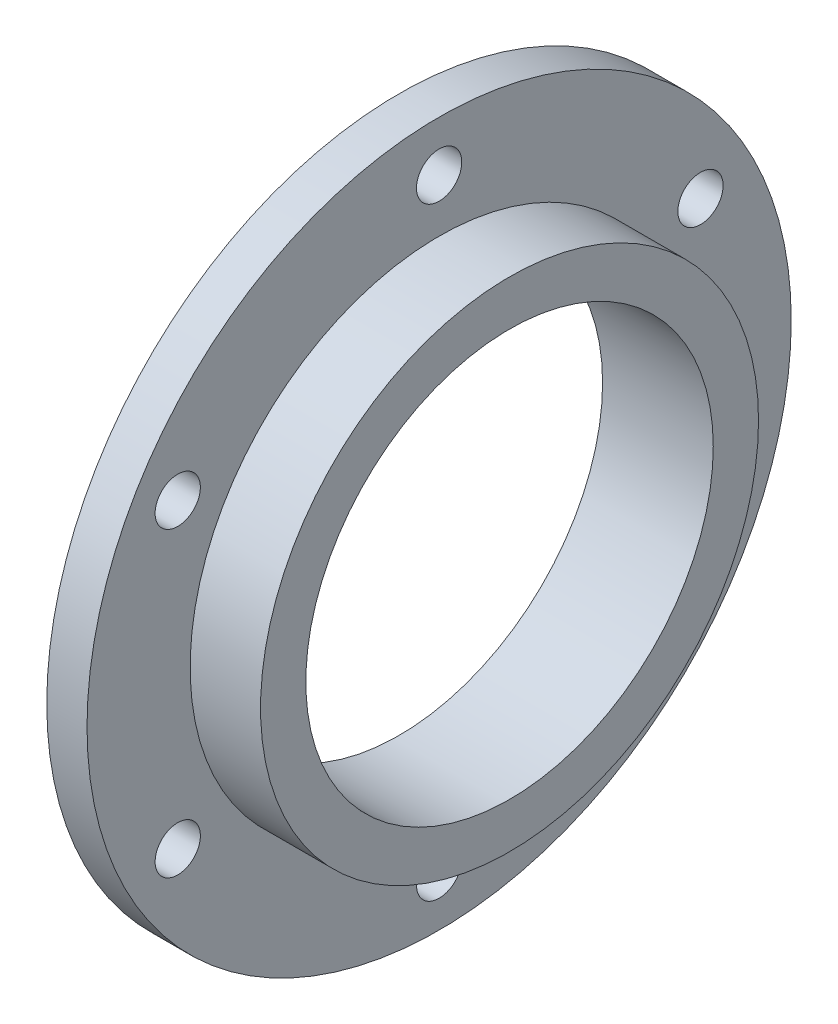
SolidWorks part; units mm, degrees
ref_plane "Front Plane" through (0, 0, 0) normal (0, 0, 1) x (1, 0, 0)
ref_plane "Top Plane" through (0, 0, 0) normal (0, 1, 0) x (1, 0, 0)
ref_plane "Right Plane" through (0, 0, 0) normal (1, 0, 0) x (0, 0, -1)
sketch "Sketch1" plane through (0, 0, 0) normal (0, 0, 1) x (1, 0, 0)
  line L0 (-22, 70) -> (-14, 70)
  line L1 (-14, 70) -> (-14, 49.5)
  line L2 (-14, 49.5) -> (0, 49.5)
  line L3 (0, 49.5) -> (0, 40.5)
  line L4 (0, 40.5) -> (-22, 40.5)
  line L5 (-22, 40.5) -> (-22, 70)
  line L6 (0, 0) -> (-22, 0) construction
  dimension "D1" = 22
  dimension "D2" = 8
  dimension "D3" = 9
  dimension "D4" = 40.5
  dimension "D5" = 29.5
revolve "Revolve1" add sketch "Sketch1" angle 360 about L6
sketch "Sketch2" plane through (-22, 0, 0) normal (-1, 0, 0) x (0, 0, 1)
  line L0 (0, 0) -> (0, 60) construction
  circle A0 centre (0, 60) radius 4.5
  dimension "D1" = 60
  dimension "D2" = 9
extrude "Cut-Extrude1" cut sketch "Sketch2" against normal blind 10
pattern_circular "CirPattern1" count 6 over 360 about axis through (0, 0, 0) along (1, 0, 0) of "Cut-Extrude1"
